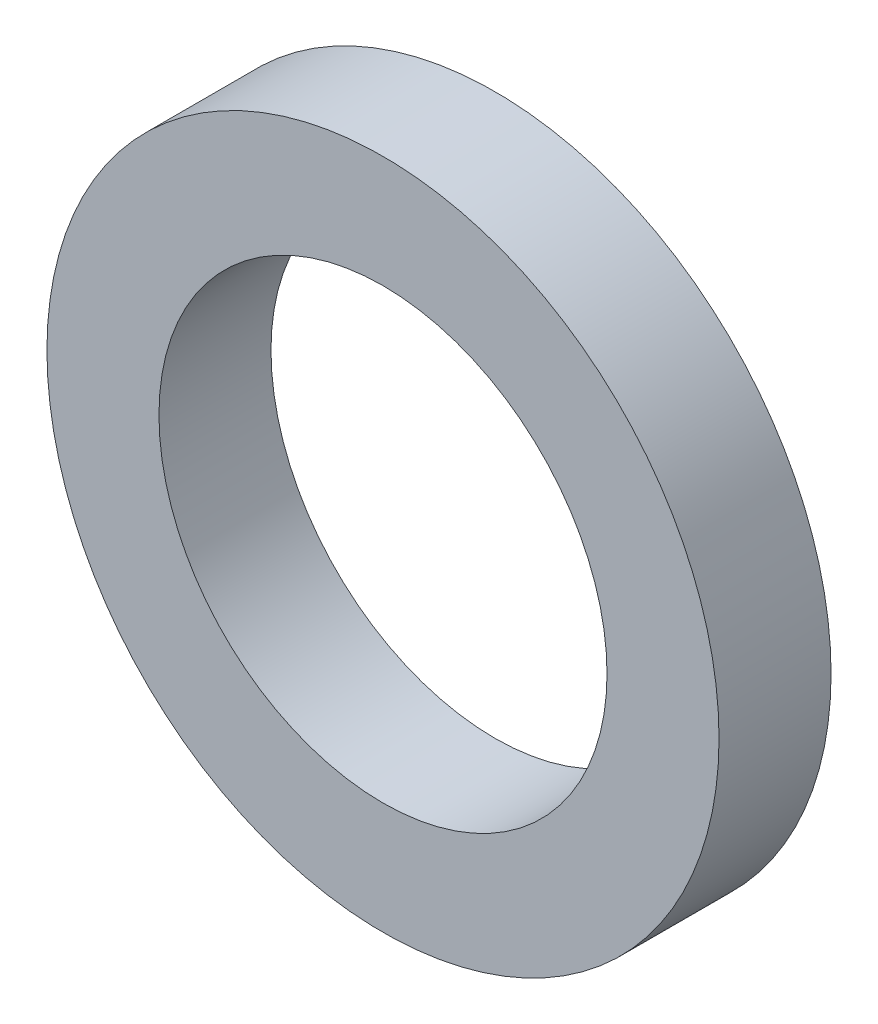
SolidWorks part; units mm, degrees
ref_plane "Plane1" through (0, 0, 0) normal (0, 0, 1) x (1, 0, 0)
ref_plane "Plane2" through (0, 0, 0) normal (0, 1, 0) x (1, 0, 0)
ref_plane "Plane3" through (0, 0, 0) normal (1, 0, 0) x (0, 0, -1)
sketch "Sketch1" plane through (0, 0, 0) normal (0, 0, 1) x (1, 0, 0)
  circle A0 centre (0, 0) radius 9.525
  circle A1 centre (0, 0) radius 6.35
  dimension "D1" = 19.05
  dimension "D2" = 12.7
extrude "Base-Extrude" add sketch "Sketch1" along normal blind 3.175
